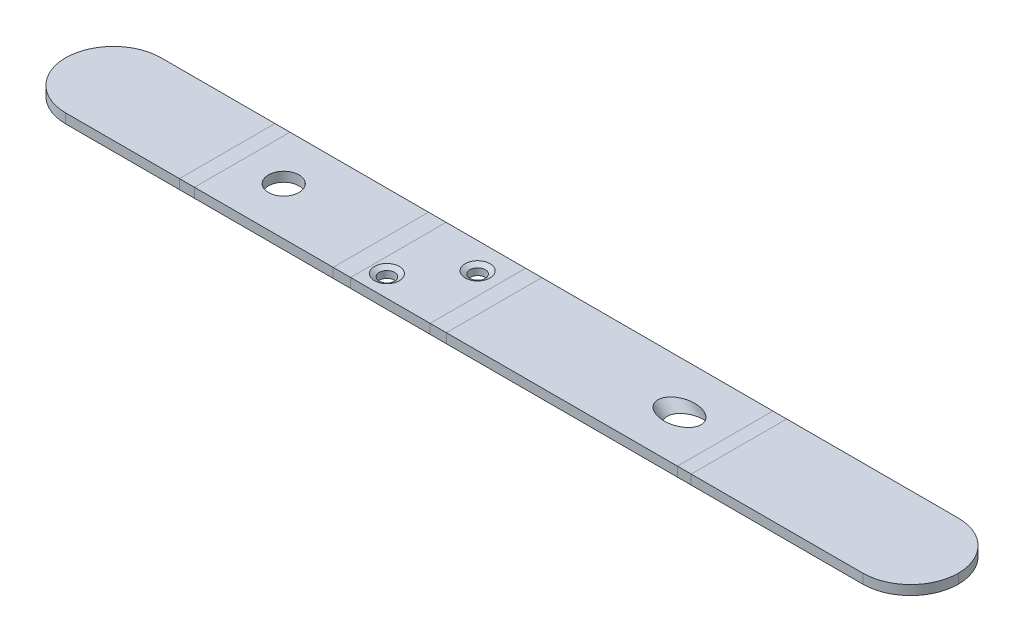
SolidWorks part; units mm, degrees
ref_plane "Plan1" through (0, 0, 0) normal (0, 0, 1) x (1, 0, 0)
ref_plane "Plan2" through (0, 0, 0) normal (0, 1, 0) x (1, 0, 0)
ref_plane "Plan3" through (0, 0, 0) normal (1, 0, 0) x (0, 0, -1)
sketch "Esquisse1" plane through (0, 0, 0) normal (0, 0, 1) x (1, 0, 0)
  line L0 (68.2621, 55.2895) -> (21.9761, 47.128)
  line L1 (21.9761, 47.128) -> (0, 0)
  line L2 (0, 0) -> (-22, 0)
  line L3 (-22, 0) -> (-33.2867, 31.0099)
  line L4 (-33.2867, 31.0099) -> (-67.7549, 37.0875)
  dimension "D1" = 35
  dimension "D2" = 33
  dimension "D3" = 22
  dimension "D4" = 52
  dimension "D5" = 47
  dimension "D6" = 120
  dimension "D7" = 110
  dimension "D8" = 115
  dimension "D9" = 125
extrude "Extru.-Mince1" add sketch "Esquisse1" along normal blind 20 thin
fillet "Congé1" radius 10 8 edges at (-67.5813, 38.0724, 0) (67.9148, 57.2591, 10) (68.2621, 55.2895, 10) (-67.7549, 37.0875, 10) (-67.4076, 39.0572, 10) (68.0885, 56.2743, 20) (-67.5813, 38.0724, 20) (68.0885, 56.2743, 0)
sketch "Esquisse2" plane through (0, 2, 0) normal (0, 1, 0) x (-1, 0, 0)
  line L0 (20.5996, 20) -> (20.5996, 0) construction
  line L1 (1.2741, 20) -> (20.5996, 20) construction
  line L2 (0, 20) -> (22, 20) construction
  circle A0 centre (16.0996, 15.5) radius 1.6
  circle A1 centre (7.0996, 5.5) radius 1.6
  dimension "D5" = 3.2
  dimension "D1" = 4.5
  dimension "D2" = 9
  dimension "D3" = 4.5
  dimension "D4" = 10
extrude "Enlèv. mat.-Extru.1" cut sketch "Esquisse2" against normal through all
sketch "Esquisse3" plane through (-17.5471, -6.3866, 0) normal (0.9397, 0.342, 0) x (0, 0, -1)
  line L0 (-20, 8.9249) -> (-20, 41.6791) construction
  line L1 (-20, 41.6791) -> (0, 41.6791) construction
  circle A0 centre (-10, 30.6791) radius 3.2
  dimension "D1" = 6.4
  dimension "D2" = 10
  dimension "D3" = 11
extrude "Enlèv. mat.-Extru.2" cut sketch "Esquisse3" against normal mid plane 120
sheet metal parameters "Tôlerie 1" parameters "D1"=2
bend "Pli dans angle2" parameters "D1"=0
flatten bends "Dépliage 1"
sketch "Esquisse-Angle1" plane through (0, 2, 0) normal (0, 1, 0) x (-1, 0, 0)
  line L0 (0.8466, 20) -> (0.8466, 0) construction
  line L1 (-50.7056, 0) -> (-50.7056, 20) construction
  line L2 (21.0318, 0) -> (21.0318, 20) construction
  line L3 (53.4796, 20) -> (53.4796, 0) construction
bend "Pli dans angle1" bend angle 70 parameters "D1"=0, "D5"=1
bend "Pli dans angle3" bend angle 55 parameters "D1"=0, "D5"=3
bend "Pli dans angle4" bend angle 60 parameters "D1"=0, "D5"=4
process bends "Pliage 1" parameters "D1"=0
sketch "Esquisse-Plate1" plane through (0, 2, 0) normal (0, 1, 0) x (-1, 0, 0)
chamfer "Chanfrein1" distance 1 angle 30 2 edges at (-17.6996, 2, 15.5) (-8.6996, 2, 5.5)
unfold "Déplier1"
fold "Plier1"
unfold "Déplier2"
flat pattern "Etat déplié1"
sketch "Lignes de pliage1" plane through (0, 0, 0) normal (0, 1, 0) x (-1, 0, 0)
bend of the flat pattern "Dépliage-<Pli dans angle1>1"
bend of the flat pattern "Dépliage-<Pli dans angle2>1"
bend of the flat pattern "Dépliage-<Pli dans angle3>1"
bend of the flat pattern "Dépliage-<Pli dans angle4>1"
